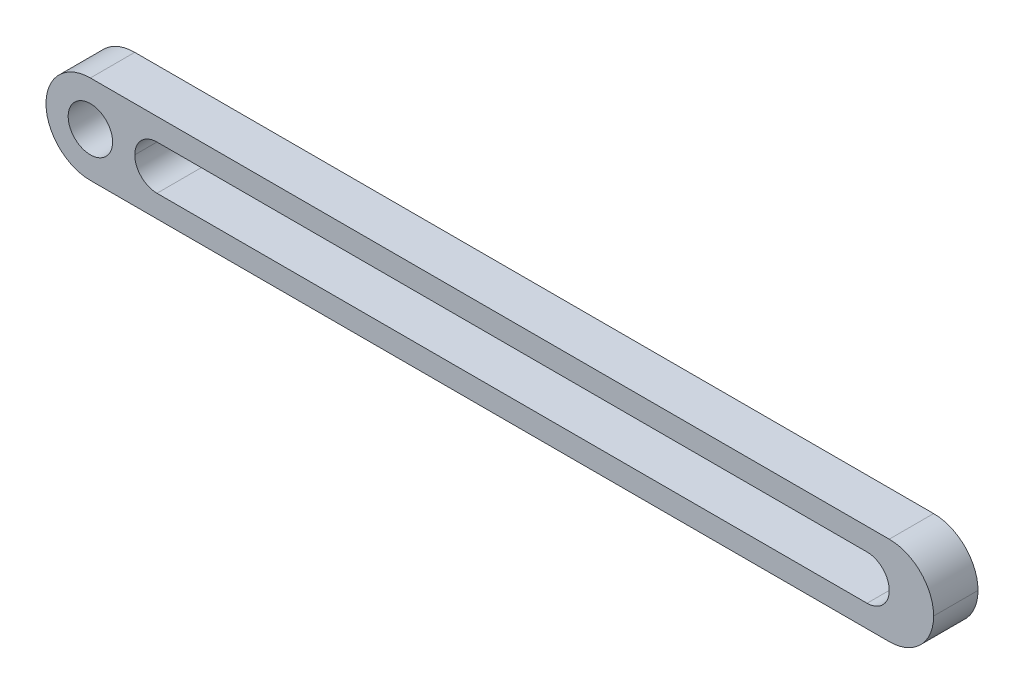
SolidWorks part; units mm, degrees
ref_plane "Front Plane" through (0, 0, 0) normal (0, 0, 1) x (1, 0, 0)
ref_plane "Top Plane" through (0, 0, 0) normal (0, 1, 0) x (1, 0, 0)
ref_plane "Right Plane" through (0, 0, 0) normal (1, 0, 0) x (0, 0, -1)
sketch "Sketch1" plane through (0, 0, 0) normal (0, 0, 1) x (1, 0, 0)
  line L1 (0, 0) -> (200, 0)
  line L2 (0, 0) -> (0, 20)
  line L3 (0, 20) -> (200, 20)
  line L4 (200, 0) -> (200, 20)
  dimension "D1" = 200
  dimension "D2" = 20
extrude "Boss-Extrude1" add sketch "Sketch1" along normal blind 10
fillet "Fillet1" radius 10 4 edges at (200, 0, 5) (200, 20, 5) (0, 0, 5) (0, 20, 5)
sketch "Sketch2" plane through (0, 0, 10) normal (0, 0, 1) x (1, 0, 0)
  line L0 (10, 0) -> (190, 0) construction
  circle A0 centre (10, 10) radius 5
  dimension "D1" = 10
  dimension "D2" = 10
  dimension "D3" = 10
extrude "Cut-Extrude1" cut sketch "Sketch2" against normal through all
sketch "Sketch3" plane through (0, 0, 10) normal (0, 0, 1) x (1, 0, 0)
  line L0 (10, 0) -> (190, 0) construction
  line L1 (20, 15) -> (190, 15)
  line L2 (20, 15) -> (20, 5)
  line L3 (20, 5) -> (190, 5)
  line L4 (190, 15) -> (190, 5)
  circle A0 centre (10, 10) radius 5 construction
  dimension "D1" = 10
  dimension "D2" = 5
  dimension "D3" = 10
  dimension "D4" = 10
extrude "Cut-Extrude2" cut sketch "Sketch3" against normal through all
fillet "Fillet3" radius 5 4 edges at (190, 15, 5) (190, 5, 5) (20, 5, 5) (20, 15, 5)
